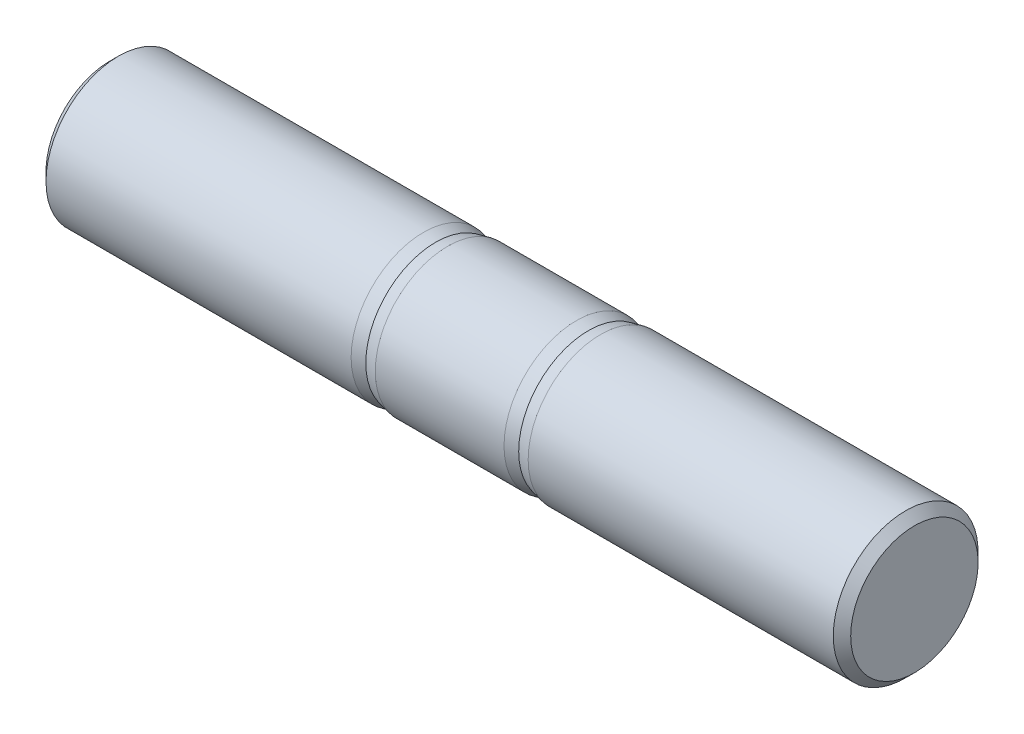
SolidWorks part; units mm, degrees
ref_plane "Front" through (0, 0, 0) normal (0, 0, 1) x (1, 0, 0)
ref_plane "Top" through (0, 0, 0) normal (0, 1, 0) x (1, 0, 0)
ref_plane "Right" through (0, 0, 0) normal (1, 0, 0) x (0, 0, -1)
other "Configuration Table"
sketch "Sketch1" plane through (0, 0, 0) normal (0, 0, 1) x (1, 0, 0)
  line L0 (-1.3108, 0) -> (30.3862, 0) construction
  line L1 (0, 0) -> (0, 18)
  line L2 (0, 18) -> (78, 18)
  line L3 (78, 18) -> (84, 16.701)
  line L4 (84, 16.701) -> (116, 16.701)
  line L5 (116, 16.701) -> (122, 18)
  line L6 (122, 18) -> (200, 18)
  line L7 (200, 18) -> (200, 0)
  line L8 (200, 0) -> (0, 0)
revolve "Base" add sketch "Sketch1" angle 360 about L0
chamfer "HeadChamfer" distance 2.165 angle 45 2 edges at (0, 0, 18) (200, 0, 18)
sketch "Sketch4" plane through (0, 0, 0) normal (0, 0, 1) x (1, 0, 0)
  line L0 (78, 16.701) -> (84, 18)
  line L1 (78, 18) -> (78, -18) construction
  line L2 (84, 18) -> (116, 18)
  line L3 (116, 18) -> (122, 16.701)
  line L4 (122, 18) -> (122, -18) construction
  line L5 (122, 16.701) -> (78, 16.701)
  line L6 (-7.8091, 0) -> (106.8365, 0) construction
  line L8 (84, 33.6577) -> (84, 2.3423) construction
  line L10 (84, 16.701) -> (84, -16.701) construction
  line L11 (84, 16.701) -> (116, 16.701) construction
revolve "BaseBody" add sketch "Sketch4" angle 360 about L6
sketch "Sketch2" plane through (0, 0, 0) normal (0, 0, 1) x (1, 0, 0)
  line L0 (197.835, 16.1251) -> (198.9175, 18)
  line L1 (198.9175, 18) -> (198.9175, 18.5)
  line L2 (198.9175, 18.5) -> (196.7525, 18.5)
  line L3 (196.7525, 18.5) -> (196.7525, 18)
  line L4 (196.7525, 18) -> (197.835, 16.1251)
  line L5 (0, 0) -> (114.8799, 0) construction
  line L6 (197.835, 18) -> (197.835, -18) construction
revolve "Cut-Revolve10" [suppressed] cut sketch "Sketch2" angle 360 about L5
pattern_linear "LPattern10" [suppressed] count 30 spacing 2.598 along (1, 0, 0)
sketch "Sketch3" plane through (0, 0, 0) normal (0, 0, 1) x (1, 0, 0)
  line L0 (2.165, 16.1251) -> (3.2475, 18)
  line L1 (3.2475, 18) -> (3.2475, 18.5)
  line L2 (3.2475, 18.5) -> (1.0825, 18.5)
  line L3 (1.0825, 18.5) -> (1.0825, 18)
  line L4 (1.0825, 18) -> (2.165, 16.1251)
  line L5 (0, 0) -> (15.3216, 0) construction
  line L6 (0, 15.835) -> (0, -15.835) construction
  line L7 (2.165, 18) -> (2.165, -18) construction
revolve "Cut-Revolve11" [suppressed] cut sketch "Sketch3" angle 360 about L5
pattern_linear "LPattern11" [suppressed] count 30 spacing 2.598 along (1, 0, 0)
equation "\"D2@Sketch1\" = \"X@Sketch1\""
equation "\"D2@ThreadCosmetic2\" = \"D2@ThreadCosmetic1\""
equation "\"b@ThreadCosmetic2\" = \"b@Sketch1\""
equation "\"D1@HeadChamfer\" =  ( \"d@Sketch1\" - \"D2@ThreadCosmetic1\" )  / 2"
equation "\"D1@Sketch1\" = \"b@Sketch1\""
equation "\"D5@Sketch2\" = \"d@Sketch1\""
equation "\"D4@Sketch2\" =  ( \"d@Sketch1\" - \"D2@ThreadCosmetic2\" )  / 2"
equation "\"D3@LPattern10\" = \"D4@Sketch2\" * 1.2"
equation "\"D1@LPattern10\" = \"b@ThreadCosmetic2\" / \"D3@LPattern10\""
equation "\"D3@Sketch3\" = \"d@Sketch1\""
equation "\"D5@Sketch3\"  =  ( \"d@Sketch1\" - \"D2@ThreadCosmetic1\" )  / 2"
equation "\"D3@LPattern11\" = \"D5@Sketch3\" * 1.2"
equation "\"D1@LPattern11\" = \"D1@ThreadCosmetic1\" / \"D3@LPattern11\""
equation "\"D1@ThreadCosmetic1\" = \"b@Sketch1\""
